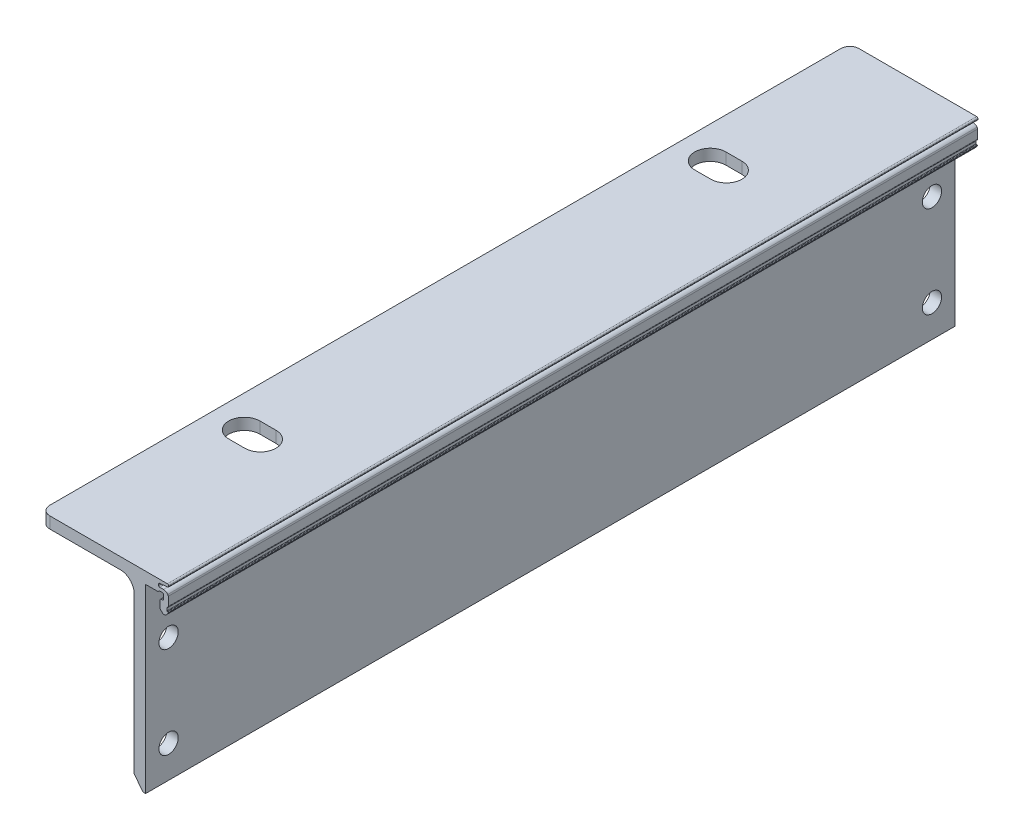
SolidWorks part; units mm, degrees
ref_plane "前视基准面" through (0, 0, 0) normal (0, 0, 1) x (1, 0, 0)
ref_plane "上视基准面" through (0, 0, 0) normal (0, 1, 0) x (1, 0, 0)
ref_plane "右视基准面" through (0, 0, 0) normal (1, 0, 0) x (0, 0, -1)
sketch "草图1" plane through (0, 0, 0) normal (0, 0, 1) x (1, 0, 0)
  line L0 (2329.984, -3290.1038) -> (2355.384, -3290.1038)
  line L1 (2329.984, -3292.6038) -> (2350.384, -3292.6038)
  line L2 (2352.884, -3292.6038) -> (2355.384, -3292.6038)
  line L3 (2350.384, -3292.6038) -> (2350.384, -3329.6038)
  line L4 (2352.884, -3292.6038) -> (2352.884, -3332.1038)
  line L5 (2355.384, -3292.6038) -> (2355.384, -3290.1038) construction
  line L6 (2355.384, -3290.1038) -> (2357.924, -3290.1038) construction
  line L8 (2329.984, -3290.1038) -> (2329.984, -3292.6038)
  line L10 (2352.884, -3332.1038) -> (2352.284, -3332.1038)
  line L11 (2350.384, -3329.6038) -> (2352.284, -3332.1038)
  line L12 (2356.524, -3292.3038) -> (2355.988, -3292.3038)
  line L13 (2357.5972, -3295.408) -> (2357.724, -3295.408)
  line L14 (2357.624, -3290.1038) -> (2357.924, -3290.1038) construction
  line L15 (2357.8006, -3295.5917) -> (2357.3831, -3296.0891)
  line L16 (2357.4972, -3294.808) -> (2357.4972, -3295.308)
  line L17 (2357.824, -3295.508) -> (2357.824, -3295.5274)
  line L18 (2357.824, -3292.376) -> (2357.824, -3294.2738)
  line L19 (2356.324, -3293.7038) -> (2356.524, -3293.7038)
  line L20 (2356.024, -3295.4545) -> (2356.024, -3294.0038)
  line L21 (2357.7449, -3290.6914) -> (2355.9031, -3290.8849)
  line L22 (2355.724, -3291.0839) -> (2355.724, -3291.4038)
  line L23 (2355.924, -3291.6038) -> (2356.77, -3291.6038)
  line L24 (2357.924, -3290.4038) -> (2357.924, -3290.4925)
  line L25 (2356.465, -3296.0891) -> (2356.0943, -3295.6474)
  line L26 (2356.824, -3293.4038) -> (2356.824, -3292.6038)
  line L27 (2357.924, -3290.4038) -> (2357.924, -3290.1038) construction
  line L28 (2355.384, -3292.6038) -> (2355.4683, -3292.6038)
  line L29 (2355.384, -3290.1038) -> (2357.624, -3290.1038)
  arc A0 (2357.4972, -3294.808) -> (2357.6606, -3294.5409) centre (2357.7972, -3294.808) cw
  arc A1 (2356.77, -3291.6038) -> (2357.7198, -3292.0704) centre (2356.77, -3292.8038) cw
  arc A2 (2357.824, -3295.5274) -> (2357.8006, -3295.5917) centre (2357.724, -3295.5274) cw
  arc A3 (2355.724, -3291.0839) -> (2355.9031, -3290.8849) centre (2355.924, -3291.0839) cw
  arc A4 (2357.924, -3290.4925) -> (2357.7449, -3290.6914) centre (2357.724, -3290.4925) cw
  arc A5 (2355.7282, -3292.4538) -> (2355.4683, -3292.6038) centre (2355.4683, -3292.3038) cw
  arc A6 (2357.624, -3290.1038) -> (2357.924, -3290.4038) centre (2357.624, -3290.4038) cw
  arc A7 (2357.5972, -3295.408) -> (2357.4972, -3295.308) centre (2357.5972, -3295.308) cw
  arc A8 (2357.824, -3294.2738) -> (2357.6606, -3294.5409) centre (2357.524, -3294.2738) cw
  arc A9 (2355.924, -3291.6038) -> (2355.724, -3291.4038) centre (2355.924, -3291.4038) cw
  arc A10 (2356.524, -3292.3038) -> (2356.824, -3292.6038) centre (2356.524, -3292.6038) cw
  arc A11 (2356.0943, -3295.6474) -> (2356.024, -3295.4545) centre (2356.324, -3295.4545) cw
  arc A12 (2355.7282, -3292.4538) -> (2355.988, -3292.3038) centre (2355.988, -3292.6038) cw
  arc A13 (2357.7198, -3292.0704) -> (2357.824, -3292.376) centre (2357.324, -3292.376) cw
  arc A14 (2356.024, -3294.0038) -> (2356.324, -3293.7038) centre (2356.324, -3294.0038) cw
  arc A15 (2356.824, -3293.4038) -> (2356.524, -3293.7038) centre (2356.524, -3293.4038) cw
  arc A16 (2357.3831, -3296.0891) -> (2356.465, -3296.0891) centre (2356.924, -3295.7038) cw
  arc A17 (2357.724, -3295.408) -> (2357.824, -3295.508) centre (2357.724, -3295.508) cw
  dimension "D1" = 39.5
  dimension "D2" = 0.6
  dimension "D3" = 2.5
  dimension "D4" = 20.4
  dimension "D5" = 127.235
extrude "凸台-拉伸1" add sketch "草图1" along normal mid plane 176.45
fillet "圆角2" radius 3 1 edges at (2350.384, -3292.6038, 0)
sketch "草图2" plane through (0, -3290.1038, 0) normal (0, 1, 0) x (1, 0, 0)
  line L0 (2338.734, 54.2) -> (2338.734, 47.4) construction
  line L3 (2370.3278, 0) -> (2329.984, 0) construction
  line L5 (2329.984, -88.225) -> (2329.984, 88.225) construction
  line L6 (2340.484, -47.4) -> (2336.984, -47.4)
  line L7 (2340.484, -54.2) -> (2336.984, -54.2)
  line L9 (2340.484, 54.2) -> (2336.984, 54.2)
  line L10 (2340.484, 47.4) -> (2336.984, 47.4)
  arc A0 (2336.984, -54.2) -> (2336.984, -47.4) centre (2336.984, -50.8) cw
  arc A1 (2336.984, 54.2) -> (2336.984, 47.4) centre (2336.984, 50.8) ccw
  arc A2 (2340.484, -47.4) -> (2340.484, -54.2) centre (2340.484, -50.8) cw
  arc A4 (2340.484, 47.4) -> (2340.484, 54.2) centre (2340.484, 50.8) ccw
  dimension "D4" = 8.75
  dimension "D1" = 101.6
  dimension "D5" = 3.5
  dimension "D6" = 3.4
extrude "切除-拉伸1" cut sketch "草图2" against normal through all
sketch "草图3" plane through (2350.384, 0, 0) normal (-1, 0, 0) x (0, 0, 1)
  line L0 (-88.225, -3295.6038) -> (-88.225, -3329.6038) construction
  line L1 (88.225, -3290.1038) -> (-88.225, -3290.1038) construction
  line L2 (0, -3290.1038) -> (0, -3332.1038) construction
  line L3 (88.225, -3332.1038) -> (-88.225, -3332.1038) construction
  circle A0 centre (-83.225, -3305.1038) radius 2.1
  circle A2 centre (-83.225, -3325.1038) radius 2.1
  circle A5 centre (83.225, -3305.1038) radius 2.1
  circle A7 centre (83.225, -3325.1038) radius 2.1
  dimension "D1" = 4.2
  dimension "D2" = 5
  dimension "D3" = 15
  dimension "D4" = 20
  dimension "D10" = 20
  dimension "D11" = 4.2
  dimension "D12" = 4.2
extrude "切除-拉伸2" cut sketch "草图3" against normal through all
fillet "圆角1" radius 2 2 edges at (2329.984, -3291.3538, -88.225) (2329.984, -3291.3538, 88.225)
